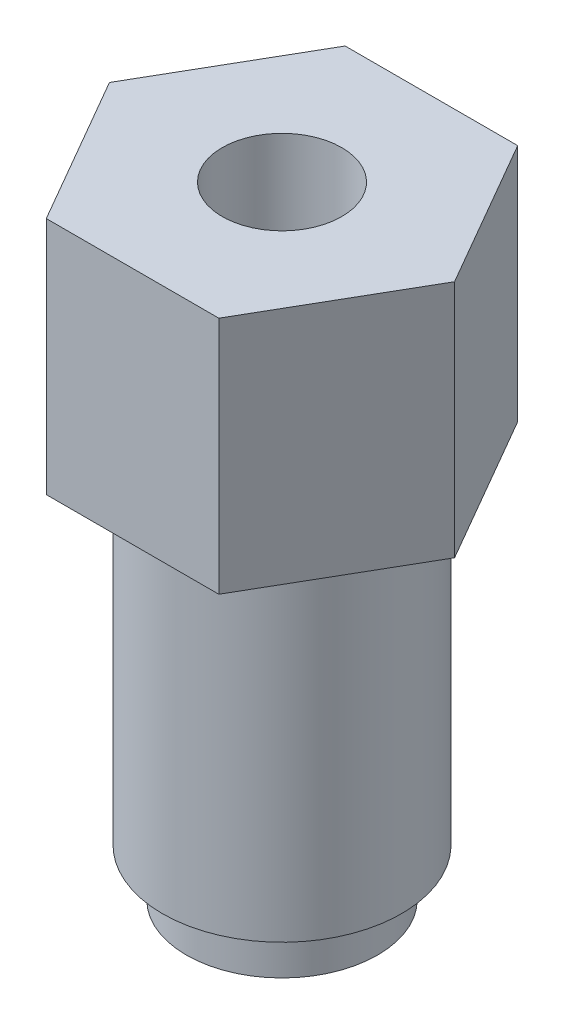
SolidWorks part; units mm, degrees
ref_plane "Front Plane" through (0, 0, 0) normal (0, 0, 1) x (1, 0, 0)
ref_plane "Top Plane" through (0, 0, 0) normal (0, 1, 0) x (1, 0, 0)
ref_plane "Right Plane" through (0, 0, 0) normal (1, 0, 0) x (0, 0, -1)
sketch "Sketch1" plane through (0, 0, 0) normal (0, 0, 1) x (1, 0, 0)
  line L0 (0, 0) -> (0, 71.6346) construction
  line L1 (-1.5875, 0) -> (-2.54, 0)
  line L2 (-2.54, 0) -> (-2.54, 1.27)
  line L3 (-2.54, 1.27) -> (-3.175, 1.27)
  line L4 (-3.175, 1.27) -> (-3.175, 10.16)
  line L5 (-3.175, 10.16) -> (-4.7625, 10.16)
  line L6 (-4.7625, 10.16) -> (-4.7625, 16.51)
  line L7 (-4.7625, 16.51) -> (-1.5875, 16.51)
  line L9 (-1.5875, 16.51) -> (-1.5875, 0)
  dimension "D1" = 6.35
  dimension "D2" = 5.08
  dimension "D3" = 9.525
  dimension "D4" = 6.35
  dimension "D5" = 16.51
  dimension "D6" = 15.24
  dimension "D7" = 3.175
revolve "Revolve1" add sketch "Sketch1" angle 360 about L0
sketch "Sketch2" plane through (0, 16.51, 0) normal (0, 1, 0) x (1, 0, 0)
  line L1 (4.5827, 0) -> (2.2914, 3.9688)
  line L2 (2.2914, 3.9688) -> (-2.2914, 3.9688)
  line L3 (-2.2914, 3.9688) -> (-4.5827, 0)
  line L4 (-4.5827, 0) -> (-2.2914, -3.9687)
  line L5 (-2.2914, -3.9687) -> (2.2914, -3.9687)
  line L6 (2.2914, -3.9687) -> (4.5827, 0)
  circle A0 centre (0, 0) radius 3.9687 construction
  dimension "D1" = 7.9375
extrude "Cut-Extrude1" cut sketch "Sketch2" against normal through all flip side to cut
